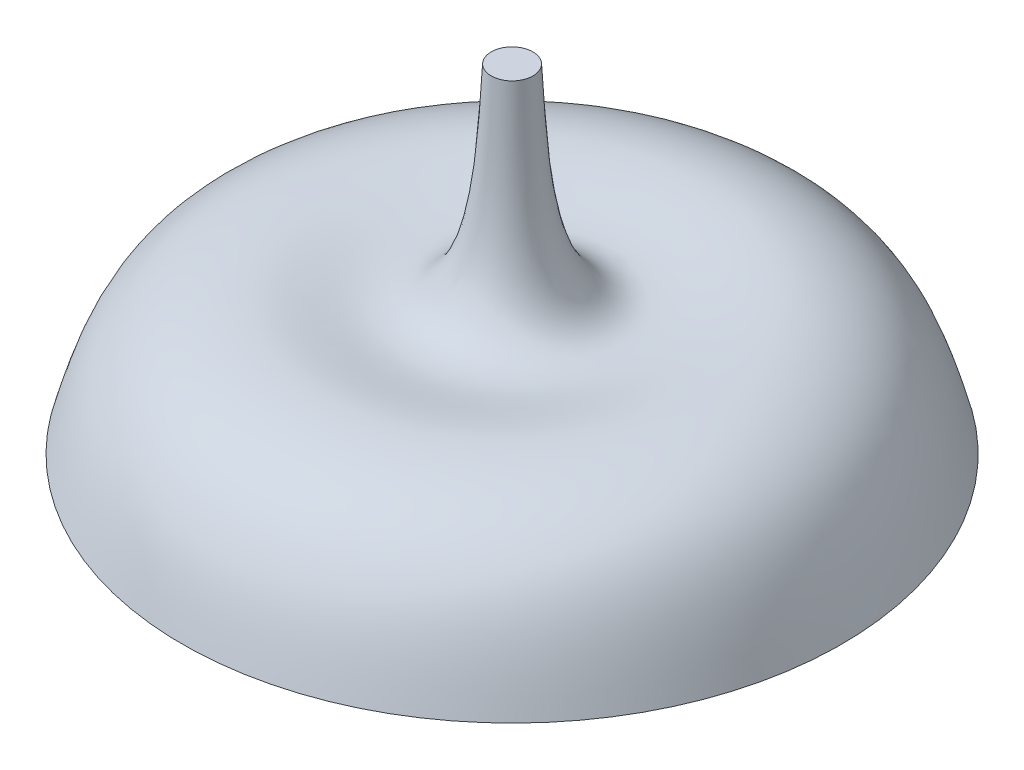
SolidWorks part; units mm, degrees
ref_plane "Ebene vorne" through (0, 0, 0) normal (0, 0, 1) x (1, 0, 0)
ref_plane "Ebene oben" through (0, 0, 0) normal (0, 1, 0) x (1, 0, 0)
ref_plane "Ebene rechts" through (0, 0, 0) normal (1, 0, 0) x (0, 0, -1)
sketch "Skizze1" plane through (0, 0, 0) normal (0, 0, 1) x (1, 0, 0)
  line L0 (0, 0) -> (0, 56.2185) construction
  line L1 (-3.4705, 56.2185) -> (0, 56.2185)
  spline S0 degree 3 poles (-54.8363, 0) (-53.0183, 6.566) (-49.5151, 19.2178) (-31.0025, 25.6341) (-5.4758, 16.4263) (-4.2975, 39.8062) (-3.4705, 56.2185) knots 0 0 0 0 0.217464 0.419027 0.592164 1 1 1 1
revolve "Rotation-Dünn1" add sketch "Skizze1" angle 360 about L0
